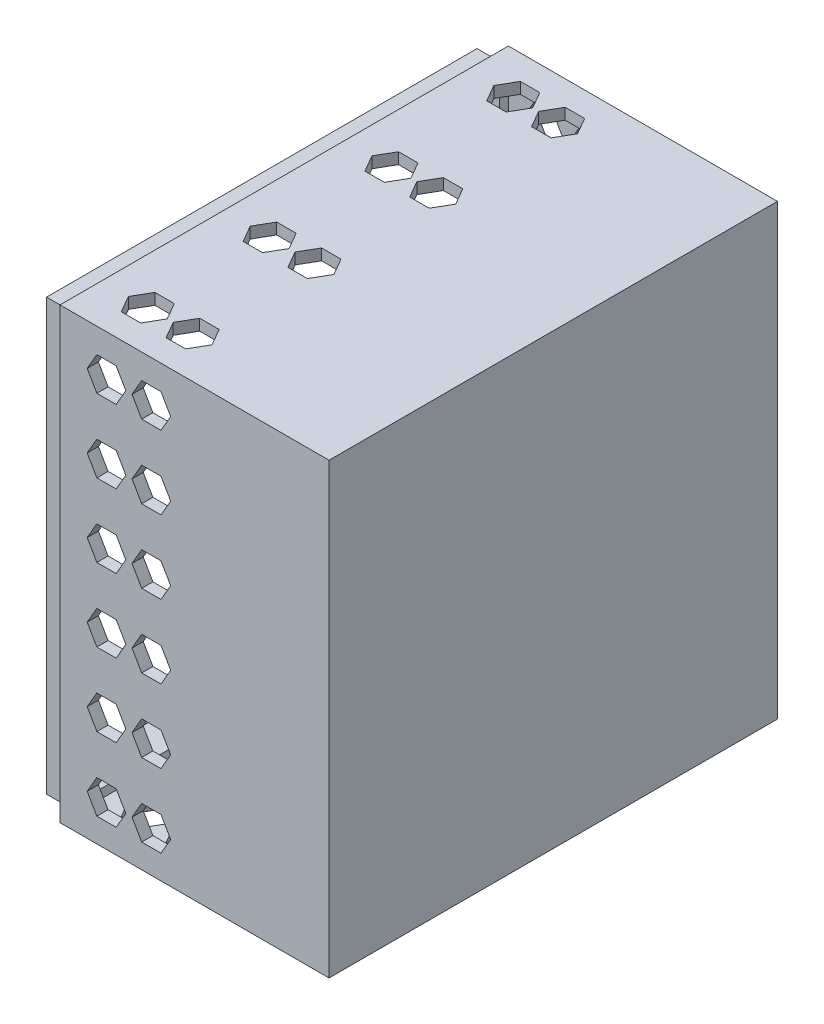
SolidWorks part; units mm, degrees
ref_plane "Front Plane" through (0, 0, 0) normal (0, 0, 1) x (1, 0, 0)
ref_plane "Top Plane" through (0, 0, 0) normal (0, 1, 0) x (1, 0, 0)
ref_plane "Right Plane" through (0, 0, 0) normal (1, 0, 0) x (0, 0, -1)
sketch "Sketch1" plane through (0, 0, 0) normal (0, 0, 1) x (1, 0, 0)
  line L1 (-48.1263, 0) -> (-15.1063, 0)
  line L2 (-48.1263, 0) -> (-48.1263, 50.8)
  line L3 (-48.1263, 50.8) -> (-15.1063, 50.8)
  line L4 (-15.1063, 0) -> (-15.1063, 50.8)
  dimension "D1" = 50.8
  dimension "D2" = 33.02
extrude "Boss-Extrude1" add sketch "Sketch1" along normal blind 50.8
sketch "Sketch2" plane through (-48.1263, 0, 0) normal (-1, 0, 0) x (0, 0, 1)
  line L1 (50.8, 50.8) -> (0, 50.8)
  line L2 (50.8, 50.8) -> (50.8, 0)
  line L3 (50.8, 0) -> (0, 0)
  line L4 (0, 50.8) -> (0, 0)
  line L5 (1.016, 1.016) -> (49.784, 1.016)
  line L6 (1.016, 1.016) -> (1.016, 49.784)
  line L7 (1.016, 49.784) -> (49.784, 49.784)
  line L8 (49.784, 1.016) -> (49.784, 49.784)
  dimension "D1" = 1.016
  dimension "D2" = 1.016
  dimension "D3" = 1.016
  dimension "D4" = 1.016
extrude "Cut-Extrude1" cut sketch "Sketch2" against normal blind 2.54
shell "Shell1" thickness 1.27
sketch "Sketch3" plane through (0, 0, 0) normal (0, 0, -1) x (-1, 0, 0)
  line L0 (37.4257, 4.6209) -> (36.3316, 6.5158)
  line L1 (42.5057, 4.6209) -> (41.4116, 6.5158)
  line L2 (41.4116, 6.5158) -> (39.2235, 6.5158)
  line L3 (39.2235, 6.5158) -> (38.1295, 4.6209)
  line L4 (38.1295, 4.6209) -> (39.2235, 2.7259)
  line L5 (39.2235, 2.7259) -> (41.4116, 2.7259)
  line L6 (41.4116, 2.7259) -> (42.5057, 4.6209)
  line L7 (36.3316, 6.5158) -> (34.1435, 6.5158)
  line L8 (34.1435, 6.5158) -> (33.0495, 4.6209)
  line L9 (33.0495, 4.6209) -> (34.1435, 2.7259)
  line L10 (34.1435, 2.7259) -> (36.3316, 2.7259)
  line L11 (36.3316, 2.7259) -> (37.4257, 4.6209)
  line L12 (37.4257, 12.9189) -> (36.3316, 14.8139)
  line L13 (36.3316, 14.8139) -> (34.1435, 14.8139)
  line L14 (34.1435, 14.8139) -> (33.0495, 12.9189)
  line L15 (33.0495, 12.9189) -> (34.1435, 11.0239)
  line L16 (34.1435, 11.0239) -> (36.3316, 11.0239)
  line L17 (36.3316, 11.0239) -> (37.4257, 12.9189)
  line L18 (37.4257, 21.2169) -> (36.3316, 23.1119)
  line L19 (36.3316, 23.1119) -> (34.1435, 23.1119)
  line L20 (34.1435, 23.1119) -> (33.0495, 21.2169)
  line L21 (33.0495, 21.2169) -> (34.1435, 19.322)
  line L22 (34.1435, 19.322) -> (36.3316, 19.322)
  line L23 (36.3316, 19.322) -> (37.4257, 21.2169)
  line L24 (37.4257, 29.515) -> (36.3316, 31.4099)
  line L25 (36.3316, 31.4099) -> (34.1435, 31.4099)
  line L26 (34.1435, 31.4099) -> (33.0495, 29.515)
  line L27 (33.0495, 29.515) -> (34.1435, 27.62)
  line L28 (34.1435, 27.62) -> (36.3316, 27.62)
  line L29 (36.3316, 27.62) -> (37.4257, 29.515)
  line L30 (37.4257, 37.813) -> (36.3316, 39.708)
  line L31 (36.3316, 39.708) -> (34.1435, 39.708)
  line L32 (34.1435, 39.708) -> (33.0495, 37.813)
  line L33 (33.0495, 37.813) -> (34.1435, 35.918)
  line L34 (34.1435, 35.918) -> (36.3316, 35.918)
  line L35 (36.3316, 35.918) -> (37.4257, 37.813)
  line L36 (37.4257, 46.111) -> (36.3316, 48.006)
  line L37 (36.3316, 48.006) -> (34.1435, 48.006)
  line L38 (34.1435, 48.006) -> (33.0495, 46.111)
  line L39 (33.0495, 46.111) -> (34.1435, 44.2161)
  line L40 (34.1435, 44.2161) -> (36.3316, 44.2161)
  line L41 (36.3316, 44.2161) -> (37.4257, 46.111)
  line L42 (42.5057, 12.9189) -> (41.4116, 14.8139)
  line L43 (41.4116, 14.8139) -> (39.2235, 14.8139)
  line L44 (39.2235, 14.8139) -> (38.1295, 12.9189)
  line L45 (38.1295, 12.9189) -> (39.2235, 11.0239)
  line L46 (39.2235, 11.0239) -> (41.4116, 11.0239)
  line L47 (41.4116, 11.0239) -> (42.5057, 12.9189)
  line L48 (42.5057, 21.2169) -> (41.4116, 23.1119)
  line L49 (41.4116, 23.1119) -> (39.2235, 23.1119)
  line L50 (39.2235, 23.1119) -> (38.1295, 21.2169)
  line L51 (38.1295, 21.2169) -> (39.2235, 19.322)
  line L52 (39.2235, 19.322) -> (41.4116, 19.322)
  line L53 (41.4116, 19.322) -> (42.5057, 21.2169)
  line L54 (42.5057, 29.515) -> (41.4116, 31.4099)
  line L55 (41.4116, 31.4099) -> (39.2235, 31.4099)
  line L56 (39.2235, 31.4099) -> (38.1295, 29.515)
  line L57 (38.1295, 29.515) -> (39.2235, 27.62)
  line L58 (39.2235, 27.62) -> (41.4116, 27.62)
  line L59 (41.4116, 27.62) -> (42.5057, 29.515)
  line L60 (42.5057, 37.813) -> (41.4116, 39.708)
  line L61 (41.4116, 39.708) -> (39.2235, 39.708)
  line L62 (39.2235, 39.708) -> (38.1295, 37.813)
  line L63 (38.1295, 37.813) -> (39.2235, 35.918)
  line L64 (39.2235, 35.918) -> (41.4116, 35.918)
  line L65 (41.4116, 35.918) -> (42.5057, 37.813)
  line L66 (42.5057, 46.111) -> (41.4116, 48.006)
  line L67 (41.4116, 48.006) -> (39.2235, 48.006)
  line L68 (39.2235, 48.006) -> (38.1295, 46.111)
  line L69 (38.1295, 46.111) -> (39.2235, 44.2161)
  line L70 (39.2235, 44.2161) -> (41.4116, 44.2161)
  line L71 (41.4116, 44.2161) -> (42.5057, 46.111)
  line L73 (15.1063, 50.8) -> (45.5863, 50.8) construction
  line L74 (45.5863, 0) -> (15.1063, 0) construction
  line L75 (45.5863, 50.8) -> (45.5863, 0) construction
  circle A0 centre (40.3176, 4.6209) radius 1.895 construction
  dimension "D3" = 2.794
  dimension "D4" = 2.7259
  dimension "D5" = 3.7899
  dimension "D6" = 3.0806
  dimension "D7" = 8.1606
  dimension "D1" = 2
  dimension "D2" = 6
extrude "Cut-Extrude2" cut sketch "Sketch3" against normal up to surface (50.8 mm away)
sketch "Sketch4" plane through (0, 0, 0) normal (0, -1, 0) x (1, 0, 0)
  line L0 (-33.0589, 46.101) -> (-34.1588, 48.006)
  line L109 (-34.1588, 48.006) -> (-36.3585, 48.006)
  line L110 (-45.5863, 1.016) -> (-45.5863, 49.784) construction
  line L111 (-38.1389, 46.101) -> (-39.2388, 48.006)
  line L112 (-39.2388, 48.006) -> (-41.4385, 48.006)
  line L113 (-41.4385, 48.006) -> (-42.5383, 46.101)
  line L114 (-42.5383, 46.101) -> (-41.4385, 44.196)
  line L115 (-41.4385, 44.196) -> (-39.2388, 44.196)
  line L116 (-39.2388, 44.196) -> (-38.1389, 46.101)
  line L118 (-36.3585, 48.006) -> (-37.4583, 46.101)
  line L119 (-37.4583, 46.101) -> (-36.3585, 44.196)
  line L120 (-36.3585, 44.196) -> (-34.1588, 44.196)
  line L121 (-34.1588, 44.196) -> (-33.0589, 46.101)
  line L122 (-33.0589, 32.3003) -> (-34.1588, 34.2053)
  line L123 (-34.1588, 34.2053) -> (-36.3585, 34.2053)
  line L124 (-36.3585, 34.2053) -> (-37.4583, 32.3003)
  line L125 (-37.4583, 32.3003) -> (-36.3585, 30.3953)
  line L126 (-36.3585, 30.3953) -> (-34.1588, 30.3953)
  line L127 (-34.1588, 30.3953) -> (-33.0589, 32.3003)
  line L128 (-33.0589, 18.4997) -> (-34.1588, 20.4047)
  line L129 (-34.1588, 20.4047) -> (-36.3585, 20.4047)
  line L130 (-36.3585, 20.4047) -> (-37.4583, 18.4997)
  line L131 (-37.4583, 18.4997) -> (-36.3585, 16.5947)
  line L132 (-36.3585, 16.5947) -> (-34.1588, 16.5947)
  line L133 (-34.1588, 16.5947) -> (-33.0589, 18.4997)
  line L134 (-33.0589, 4.699) -> (-34.1588, 6.604)
  line L135 (-34.1588, 6.604) -> (-36.3585, 6.604)
  line L136 (-36.3585, 6.604) -> (-37.4583, 4.699)
  line L137 (-37.4583, 4.699) -> (-36.3585, 2.794)
  line L138 (-36.3585, 2.794) -> (-34.1588, 2.794)
  line L139 (-34.1588, 2.794) -> (-33.0589, 4.699)
  line L140 (-38.1389, 32.3003) -> (-39.2388, 34.2053)
  line L141 (-39.2388, 34.2053) -> (-41.4385, 34.2053)
  line L142 (-41.4385, 34.2053) -> (-42.5383, 32.3003)
  line L143 (-42.5383, 32.3003) -> (-41.4385, 30.3953)
  line L144 (-41.4385, 30.3953) -> (-39.2388, 30.3953)
  line L145 (-39.2388, 30.3953) -> (-38.1389, 32.3003)
  line L146 (-38.1389, 18.4997) -> (-39.2388, 20.4047)
  line L147 (-39.2388, 20.4047) -> (-41.4385, 20.4047)
  line L148 (-41.4385, 20.4047) -> (-42.5383, 18.4997)
  line L149 (-42.5383, 18.4997) -> (-41.4385, 16.5947)
  line L150 (-41.4385, 16.5947) -> (-39.2388, 16.5947)
  line L151 (-39.2388, 16.5947) -> (-38.1389, 18.4997)
  line L152 (-38.1389, 4.699) -> (-39.2388, 6.604)
  line L153 (-39.2388, 6.604) -> (-41.4385, 6.604)
  line L154 (-41.4385, 6.604) -> (-42.5383, 4.699)
  line L155 (-42.5383, 4.699) -> (-41.4385, 2.794)
  line L156 (-41.4385, 2.794) -> (-39.2388, 2.794)
  line L157 (-39.2388, 2.794) -> (-38.1389, 4.699)
  line L158 (-45.5863, 50.8) -> (-15.1063, 50.8) construction
  line L159 (-45.5863, 0) -> (-15.1063, 0) construction
  circle A0 centre (-40.3386, 46.101) radius 1.905 construction
  dimension "D1" = 3.81
  dimension "D3" = 2
  dimension "D4" = 4
  dimension "D2" = 3.048
  dimension "D5" = 2.794
  dimension "D6" = 2.794
extrude "Cut-Extrude3" cut sketch "Sketch4" against normal up to surface (50.8 mm away)
